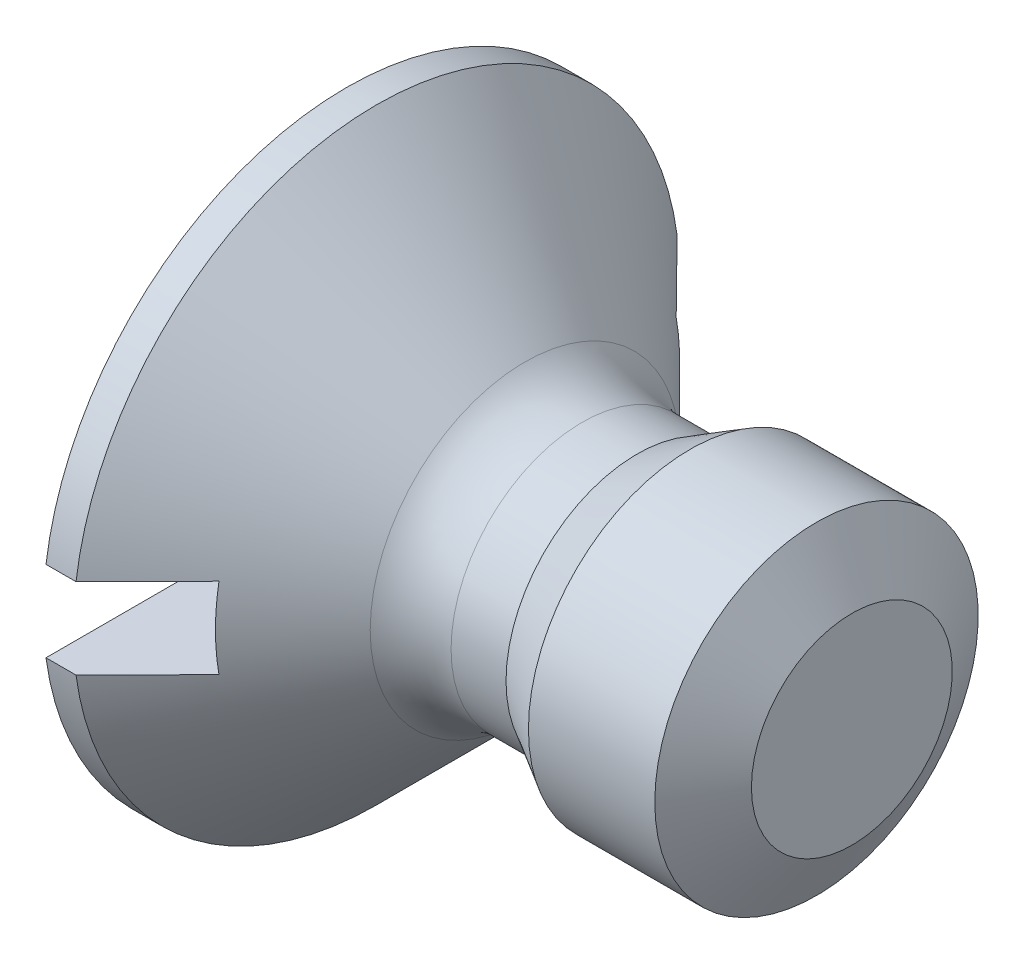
SolidWorks part; units mm, degrees
ref_plane "前视" through (0, 0, 0) normal (0, 0, 1) x (1, 0, 0)
ref_plane "上视" through (0, 0, 0) normal (0, 1, 0) x (1, 0, 0)
ref_plane "右视" through (0, 0, 0) normal (1, 0, 0) x (0, 0, -1)
sketch "尺寸草图" plane through (0, 0, 0) normal (0, 0, 1) x (1, 0, 0)
  line L0 (0, 0) -> (2.5, 0)
  point P3 (1.6, 0)
  point P4 (3, 0)
  point P5 (0.35, 0)
  point P6 (0.7, 0)
  point P7 (0.4, 0)
  point P8 (0.4, 0)
  point P9 (1, 0)
  point P10 (2, 0)
  dimension "l" = 2.5
  dimension "d" = 1.6
  dimension "dk" = 3
  dimension "p" = 0.35
  dimension "a" = 0.7
  dimension "k" = 1
  dimension "n" = 0.4
  dimension "r" = 0.4
  dimension "t" = 0.5
sketch "草图1" plane through (0, 0, 0) normal (0, 0, 1) x (1, 0, 0)
  line L0 (0, 0) -> (128.7124, 0) construction
  line L1 (0, 0) -> (0, 1.5)
  line L2 (0, 1.5) -> (0.1485, 1.5)
  line L3 (0.1485, 1.5) -> (0.8828, 0.7656)
  line L4 (1.1657, 0.6485) -> (1.4375, 0.6485)
  line L5 (1.4375, 0.6485) -> (1.7, 0.8)
  line L6 (1.7, 0.8) -> (2.5, 0.8)
  line L7 (2.5, 0.8) -> (2.5, 0)
  line L8 (0, 0) -> (2.5, 0)
  arc A0 (1.1657, 0.6485) -> (0.8828, 0.7656) centre (1.1657, 1.0485) cw
  point P12 (1, 0.6485)
  dimension "r" = 0.4
  dimension "D1" = 45
  dimension "D2" = 30
  dimension "D3" = 1.2969
  dimension "k" = 1
  dimension "d" = 1.6
  dimension "dk" = 3
  dimension "a" = 0.7
  dimension "l" = 2.5
revolve "基体-旋转" add sketch "草图1"
pattern_linear "阵列(线性)1" [suppressed]
revolve "切除-旋转1" cut sketch "草图2"
sketch "草图2"
  line L0 (2.325, 0.8) -> (2.675, 0.8)
  line L1 (2.675, 0.8) -> (2.5, 0.4969)
  line L2 (2.5, 0.4969) -> (2.325, 0.8)
  line L3 (2.5, 0.8) -> (2.5, 0.4969) construction
  line L6 (2.5, -0.625) -> (2.5, 0.625) construction
  line L8 (0, 0) -> (128.7124, 0) construction
  line L9 (3.3795, 0) -> (4.4719, 0) construction
chamfer "倒角1" distance 0.175 angle 45 1 edges at (2.5, 0, 0.8)
sketch "草图3" plane through (0, 0, 0) normal (-1, 0, 0) x (0, 0, 1)
  line L0 (0, 0) -> (1.6419, 0) construction
  line L2 (-1.4866, 0.2) -> (1.4866, 0.2)
  line L4 (-1.4866, -0.2) -> (1.4866, -0.2)
  arc A0 (1.4866, -0.2) -> (1.4866, 0.2) centre (0, 0) ccw
  circle A1 centre (0, 0) radius 1.5
  arc A2 (-1.4866, 0.2) -> (-1.4866, -0.2) centre (0, 0) ccw
  dimension "n" = 0.4
  dimension "D1" = 0
extrude "切除-拉伸1" cut sketch "草图3" against normal blind 0.5
ref_plane "Bface1" through (0.1485, 0, 0) normal (1, 0, 0) x (0, 0, -1)
equation "\"l@草图1\" = \"l@尺寸草图\""
equation "\"d@草图1\" = \"d@尺寸草图\""
equation "\"r@草图1\" = \"r@尺寸草图\""
equation "\"k@草图1\" = \"k@尺寸草图\""
equation "\"a@草图1\" = \"a@尺寸草图\""
equation "\"dk@草图1\" = \"dk@尺寸草图\""
equation "\"t@切除-拉伸1\" = \"t@尺寸草图\""
equation "\"n@草图3\" = \"n@尺寸草图\""
equation "\"p@草图2\" = \"p@尺寸草图\""
equation "\"D3@草图1\" = \"d@尺寸草图\" - \"p@尺寸草图\" * 0.866"
equation "\"D1@草图2\" = \"d@尺寸草图\" / 2"
equation "\"D1@阵列(线性)1\" =(\"l@草图1\" - \"a@草图1\" - \"k@草图1\" - \"p@草图2\" / 2) / \"p@草图2\"+1"
equation "\"D1@倒角1\" = \"p@尺寸草图\" / 2"
equation "\"D2@装饰螺纹线1\" = \"d@尺寸草图\" - \"D3@阵列(线性)1\" * 0.866"
equation "\"D3@阵列(线性)1\"  = \"p@尺寸草图\""
